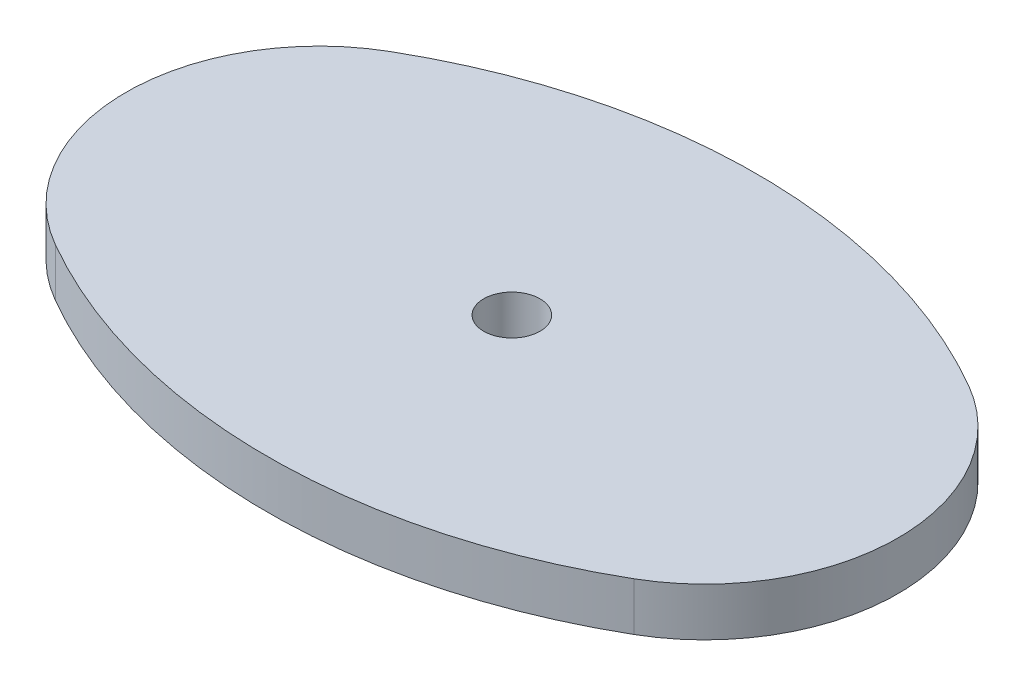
SolidWorks part; units mm, degrees
ref_plane "Front" through (0, 0, 0) normal (0, 0, 1) x (1, 0, 0)
ref_plane "Top" through (0, 0, 0) normal (0, 1, 0) x (1, 0, 0)
ref_plane "Right" through (0, 0, 0) normal (1, 0, 0) x (0, 0, -1)
sketch "Sketch1" plane through (0, 0, 0) normal (0, 1, 0) x (1, 0, 0)
  circle A0 centre (0, 0) radius 1.75
  arc A1 (-17.9741, -10.3953) -> (-17.9741, 10.3953) centre (-11.9793, 0) cw
  arc A2 (17.9948, -10.3953) -> (17.9948, 10.3953) centre (12, 0) ccw
  arc A3 (-17.9741, -10.3953) -> (17.9948, -10.3953) centre (0.0104, 20.7906) ccw
  arc A7 (17.9948, 10.3953) -> (-17.9741, 10.3953) centre (0.0104, -20.7906) ccw
extrude "Extrude1" add sketch "Sketch1" along normal blind 3
